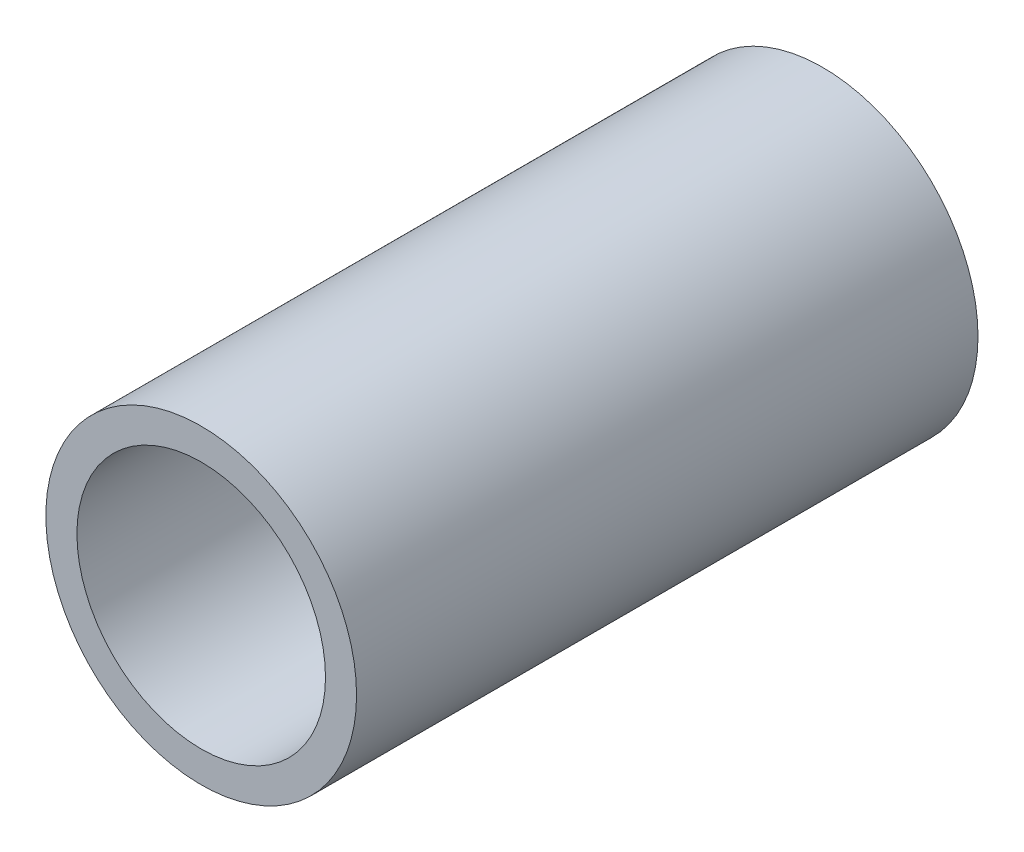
SolidWorks part; units mm, degrees
ref_plane "Face" through (0, 0, 0) normal (0, 0, 1) x (1, 0, 0)
ref_plane "Dessus" through (0, 0, 0) normal (0, 1, 0) x (1, 0, 0)
ref_plane "Droite" through (0, 0, 0) normal (1, 0, 0) x (0, 0, -1)
sketch "Esquisse1" plane through (0, 0, 0) normal (0, 0, 1) x (1, 0, 0)
  circle A0 centre (0, 0) radius 4
  circle A1 centre (0, 0) radius 5
  dimension "D1" = 10
  dimension "D2" = 8
extrude "Extrusion1" add sketch "Esquisse1" along normal blind 20
